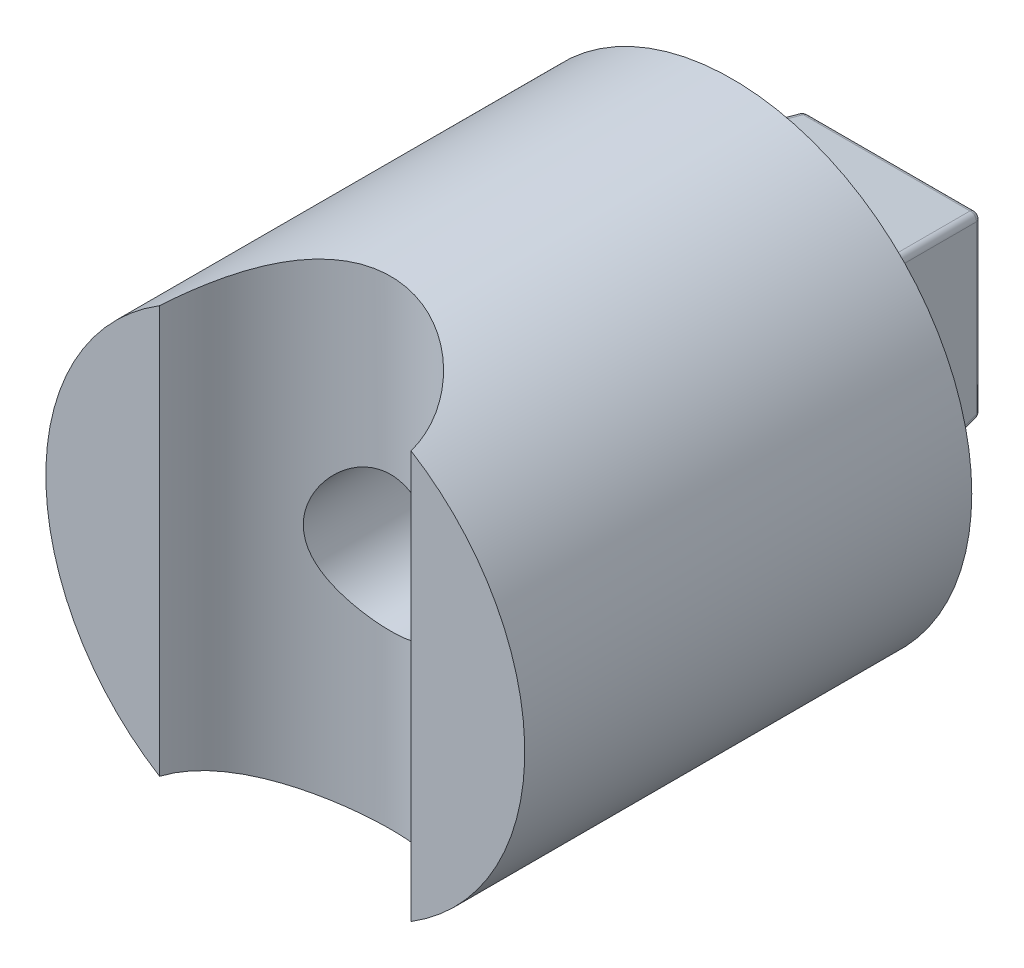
SolidWorks part; units mm, degrees
ref_plane "Face" through (0, 0, 0) normal (0, 0, 1) x (1, 0, 0)
ref_plane "Dessus" through (0, 0, 0) normal (0, 1, 0) x (1, 0, 0)
ref_plane "Droite" through (0, 0, 0) normal (1, 0, 0) x (0, 0, -1)
sketch "Esquisse1" plane through (0, 0, 0) normal (0, 0, 1) x (1, 0, 0)
  circle A0 centre (0, 0) radius 15
  dimension "D1" = 30
extrude "Extrusion1" add sketch "Esquisse1" along normal blind 28
sketch "Esquisse2" plane through (0, 0, 0) normal (0, 0, -1) x (-1, 0, 0)
  line L1 (-7.15, 7.15) -> (7.15, 7.15)
  line L2 (-7.15, 7.15) -> (-7.15, -7.15)
  line L3 (-7.15, -7.15) -> (7.15, -7.15)
  line L4 (7.15, 7.15) -> (7.15, -7.15)
  dimension "D1" = 14.3
  dimension "D2" = 7.15
  dimension "D3" = 7.15
  dimension "D4" = 14.3
extrude "Extrusion2" add sketch "Esquisse2" along normal blind 10 draft 9
sketch "Esquisse3" plane through (0, 0, -10) normal (0, 0, -1) x (-1, 0, 0)
  circle A0 centre (0, 0) radius 4.25
  dimension "D1" = 8.5
extrude "Enlèv. mat.-Extru.1" cut sketch "Esquisse3" against normal through all
fillet "Congé1" radius 0.4
sketch "Esquisse4" plane through (0, 0, 0) normal (0, 1, 0) x (1, 0, 0)
  line L0 (0, -28) -> (0, 0) construction
  line L1 (-15, -28) -> (15, -28) construction
  circle A0 centre (0, -29.4) radius 8
  dimension "D1" = 16
  dimension "D2" = 1.4
extrude "Enlèv. mat.-Extru.2" cut sketch "Esquisse4" against normal up to next and the other way up to next
